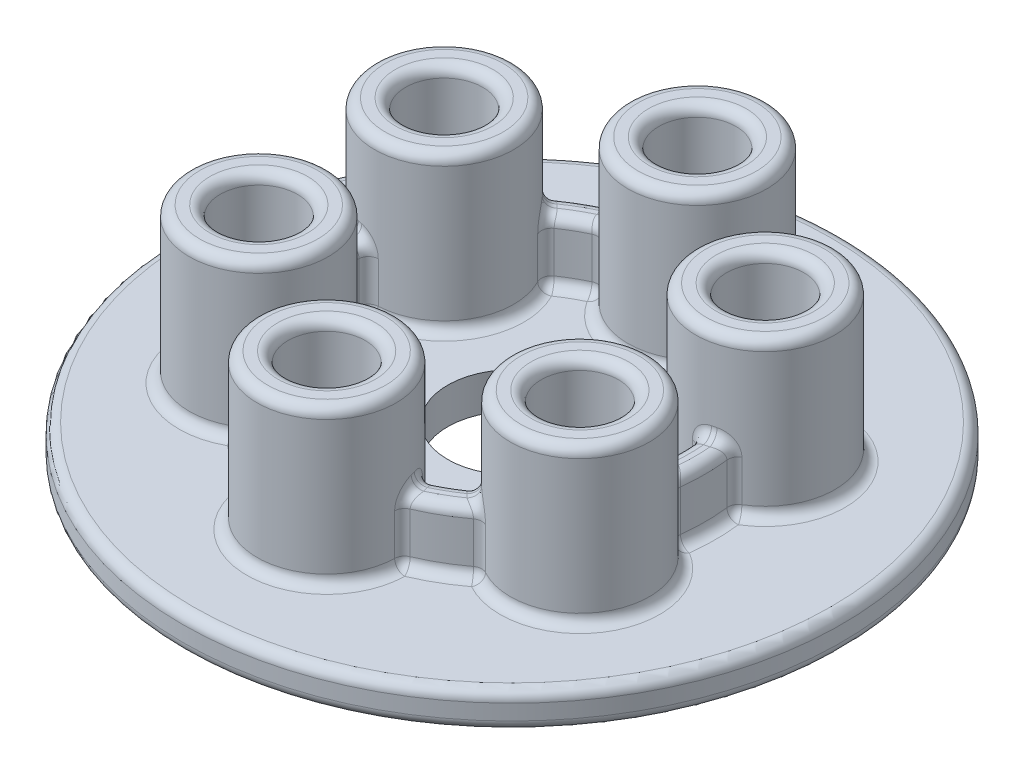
SolidWorks part; units mm, degrees
ref_plane "Front" through (0, 0, 0) normal (0, 0, 1) x (1, 0, 0)
ref_plane "Top" through (0, 0, 0) normal (0, 1, 0) x (1, 0, 0)
ref_plane "Right" through (0, 0, 0) normal (1, 0, 0) x (0, 0, -1)
sketch "Sketch1" plane through (0, 0, 0) normal (0, 1, 0) x (1, 0, 0)
  circle A0 centre (0, 0) radius 64
  dimension "D1" = 128
extrude "Extrude1" add sketch "Sketch1" along normal blind 7
sketch "Sketch2" plane through (0, 7, 0) normal (0, 1, 0) x (1, 0, 0)
  circle A0 centre (0, 0) radius 37.5
  circle A1 centre (0, 0) radius 32.5
  dimension "D1" = 75
  dimension "D2" = 5
extrude "Extrude2" add sketch "Sketch2" along normal blind 12
sketch "Sketch6" plane through (0, 7, 0) normal (0, 1, 0) x (1, 0, 0)
  circle A0 centre (0, 0) radius 12.5
  dimension "D1" = 25
extrude "Extrude6" cut sketch "Sketch6" against normal through all
fillet "Fillet1" radius 2 4 edges at (0, 19, 32.5) (0, 19, 37.5) (0, 0, 64) (0, 7, 64)
sketch "Sketch9" plane through (0, 7, 0) normal (0, 1, 0) x (1, 0, 0)
  line L0 (0, 0) -> (0, 36) construction
  circle A0 centre (0, 36) radius 13.5
  dimension "D1" = 27
  dimension "D2" = 36
extrude "Extrude8" add sketch "Sketch9" along normal blind 30
sketch "Sketch10" plane through (0, 37, 0) normal (0, 1, 0) x (1, 0, 0)
  circle A0 centre (0, 36) radius 7.5
  dimension "D1" = 15
extrude "Extrude9" cut sketch "Sketch10" against normal through all
fillet "Fillet2" radius 2 13 edges at (13.4629, 12, -35) (-13.4629, 12, -35) (13.4245, 18.214, -34.5747) (-13.4036, 18.4192, -34.3894) (-13.034, 19, -32.4837) (13.034, 19, -32.4837) (12.4093, 18.4268, -30.6842) (-12.345, 18.2482, -30.5363) (12.1613, 12, -30.1389) (-12.1613, 12, -30.1389) (0, 37, -22.5) (0, 37, -28.5) (0, 0, -28.5)
pattern_circular "CirPattern1" count 6 over 360 about axis through (0, 0, 0) along (0, 1, 0) of "Extrude8", "Extrude9", "Fillet2"
fillet "Fillet3" radius 2 48 edges at (13.8396, 7, -35.213) (18.75, 7, -32.476) (23.5755, 7, -29.592) (42.8683, 7, -24.75) (37.4152, 7, -5.621) (37.5, 7, 0) (37.4152, 7, 5.621) (42.8683, 7, 24.75) (23.5755, 7, 29.592) (18.75, 7, 32.476) (13.8396, 7, 35.213) (0, 7, 49.5) (-13.8396, 7, 35.213) (-18.75, 7, 32.476) (-23.5755, 7, 29.592) (-42.8683, 7, 24.75) (-37.4152, 7, 5.621) (-37.5, 7, 0) (-37.4152, 7, -5.621) (-42.8683, 7, -24.75) (-23.5755, 7, -29.592) (-18.75, 7, -32.476) (-13.8396, 7, -35.213) (-12.467, 7, -29.5066) (-16.25, 7, -28.1458) (-19.3199, 7, -25.55) (-19.4856, 7, -11.25) (-31.7869, 7, -3.9566) (-32.5, 7, 0) (-31.7869, 7, 3.9566) (-19.4856, 7, 11.25) (-19.3199, 7, 25.55) (-16.25, 7, 28.1458) (-12.467, 7, 29.5066) (0, 7, 22.5) (12.467, 7, 29.5066) (16.25, 7, 28.1458) (19.3199, 7, 25.55) (19.4856, 7, 11.25) (31.7869, 7, 3.9566) (32.5, 7, 0) (31.7869, 7, -3.9566) (19.4856, 7, -11.25) (19.3199, 7, -25.55) (16.25, 7, -28.1458) (12.467, 7, -29.5066) (0, 7, -49.5) (0, 7, -22.5)
